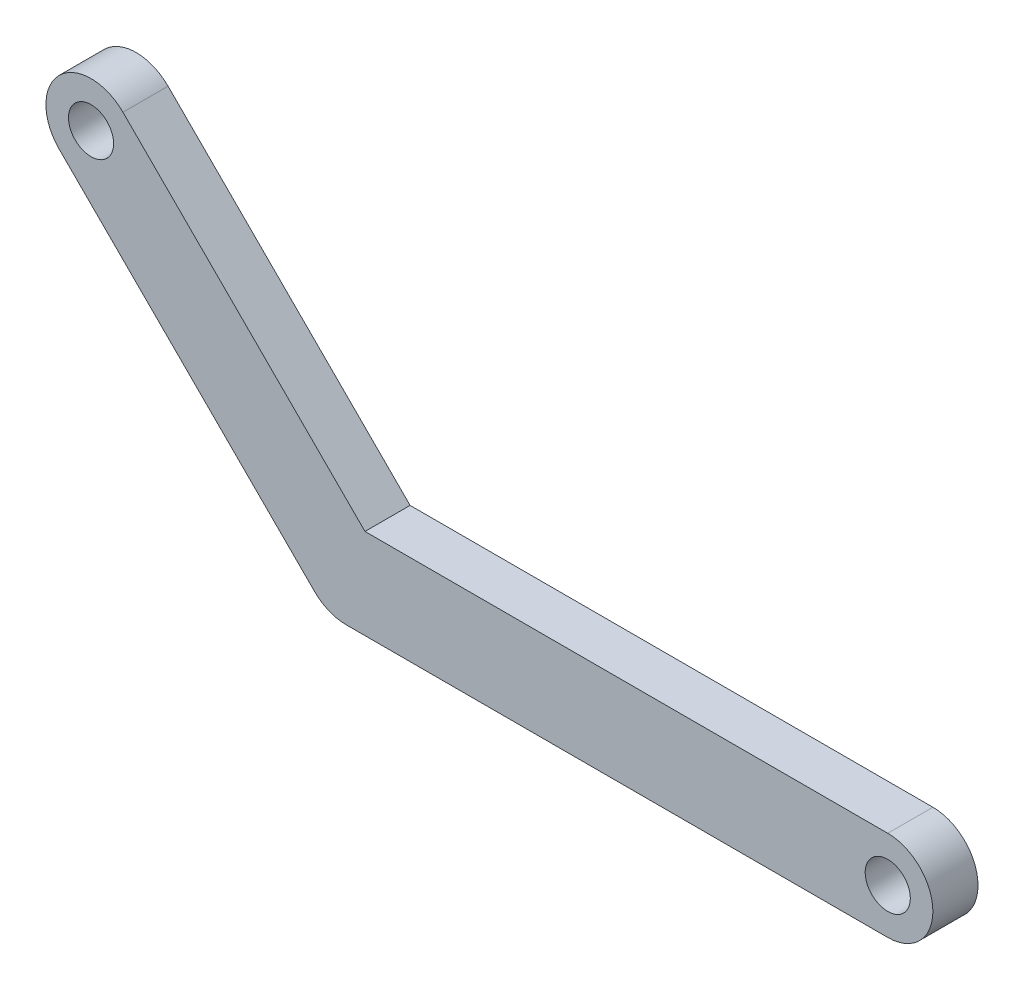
SolidWorks part; units mm, degrees
ref_plane "Front Plane" through (0, 0, 0) normal (0, 0, 1) x (1, 0, 0)
ref_plane "Top Plane" through (0, 0, 0) normal (0, 1, 0) x (1, 0, 0)
ref_plane "Right Plane" through (0, 0, 0) normal (1, 0, 0) x (0, 0, -1)
sketch "Sketch1" plane through (0, 0, 0) normal (0, 0, 1) x (1, 0, 0)
  line L0 (0, 0) -> (38.1, 0) construction
  line L1 (0, 3.175) -> (38.1, 3.175)
  line L2 (0, -3.175) -> (38.1, -3.175)
  arc A0 (0, 3.175) -> (0, -3.175) centre (0, 0) ccw
  arc A1 (38.1, -3.175) -> (38.1, 3.175) centre (38.1, 0) ccw
  circle A2 centre (38.1, 0) radius 1.5875
  point P3 (19.05, 0)
  dimension "D1" = 3.175
  dimension "D3" = 3.175
  dimension "D2" = 38.1
extrude "Boss-Extrude1" add sketch "Sketch1" along normal blind 3.175
sketch "Sketch2" plane through (0, 0, 0) normal (0, 0, 1) x (1, 0, 0)
  line L0 (0, 0) -> (-17.9605, 17.9605) construction
  line L1 (-2.2451, -2.2451) -> (-20.2056, 15.7154)
  line L2 (2.2451, 2.2451) -> (-15.7154, 20.2056)
  line L3 (0, 0) -> (38.1, 0) construction
  arc A0 (-2.2451, -2.2451) -> (2.2451, 2.2451) centre (0, 0) ccw
  arc A1 (-15.7154, 20.2056) -> (-20.2056, 15.7154) centre (-17.9605, 17.9605) ccw
  arc A2 (0, 3.175) -> (0, -3.175) centre (0, 0) ccw construction
  circle A3 centre (-17.9605, 17.9605) radius 1.5875
  circle A5 centre (38.1, 0) radius 1.5875 construction
  point P3 (-8.9803, 8.9803)
  dimension "D1" = 25.4
  dimension "D2" = 135
extrude "Boss-Extrude2" add sketch "Sketch2" along normal blind 3.175
